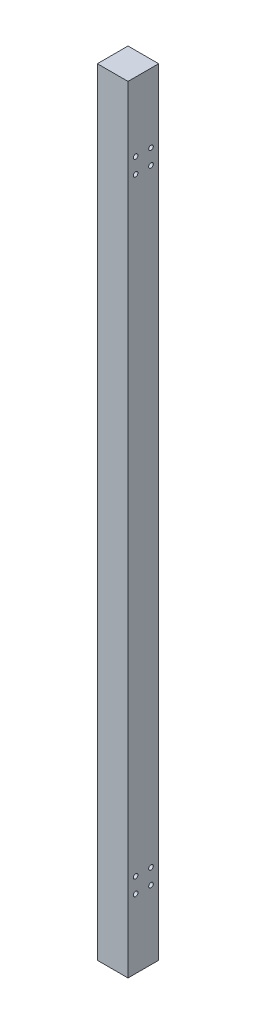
SolidWorks part; units mm, degrees
ref_plane "前视基准面" through (0, 0, 0) normal (0, 0, 1) x (1, 0, 0)
ref_plane "上视基准面" through (0, 0, 0) normal (0, 1, 0) x (1, 0, 0)
ref_plane "右视基准面" through (0, 0, 0) normal (1, 0, 0) x (0, 0, -1)
other "Configuration Table"
sketch "草图1" plane through (0, 0, 0) normal (0, 1, 0) x (1, 0, 0)
  line L1 (-30, 30) -> (30, 30)
  line L2 (-30, 30) -> (-30, -30)
  line L3 (-30, -30) -> (30, -30)
  line L4 (30, 30) -> (30, -30)
  line L5 (-30, 30) -> (30, -30) construction
  line L6 (-30, -30) -> (30, 30) construction
  point P0 (0, 0)
extrude "凸台-拉伸1" add sketch "草图1" along normal blind 1520
sketch "草图2" plane through (0, 0, 30) normal (0, 0, 1) x (1, 0, 0)
  line L0 (-30, 120) -> (30, 120)
  line L1 (-30, 1520) -> (-30, 0) construction
  line L2 (30, 1520) -> (30, 0) construction
  line L3 (-30, 0) -> (30, 0) construction
  line L4 (-30, 1400) -> (30, 1400)
  line L5 (-30, 1520) -> (30, 1520) construction
  dimension "D1" = 120
  dimension "D2" = 120
sketch "草图4" plane through (0, 0, 30) normal (0, 0, 1) x (1, 0, 0)
  line L0 (0, 1400) -> (0, 120)
  line L1 (-30, 1400) -> (30, 1400) construction
  line L2 (-30, 120) -> (30, 120) construction
  line L3 (30, 1520) -> (30, 0) construction
  line L4 (-30, 0) -> (30, 0) construction
  line L5 (-30, 1520) -> (30, 1520) construction
  point P6 (15, 1330)
  point P7 (15, 190)
  point P8 (15, 1110)
  point P9 (15, 410)
  dimension "D1" = 70
  dimension "D2" = 15
  dimension "D3" = 70
  dimension "D4" = 410
  dimension "D5" = 410
sketch "草图5" plane through (-30, 0, 0) normal (-1, 0, 0) x (0, 0, 1)
  line L0 (-30, 1520) -> (30, 1520) construction
  line L5 (30, 1400) -> (30, 120) construction
  line L6 (30, 0) -> (30, 105)
  circle A0 centre (15, 1385) radius 6
  circle A1 centre (-15, 1385) radius 6
  circle A2 centre (-15, 1355) radius 6
  circle A3 centre (15, 1355) radius 6
  circle A4 centre (15, 165) radius 6
  circle A5 centre (-15, 165) radius 6
  circle A6 centre (-15, 135) radius 6
  circle A7 centre (15, 135) radius 6
  point P0 (15, 1385)
  point P16 (15, 165)
  dimension "D3" = 2
  dimension "D1" = 135
  dimension "D2" = 15
  dimension "D4" = 2
hole_wizard "M8 六角头螺栓的柱形沉头孔1" positions "草图8" profile "草图9" counterbore size "M8" standard "GB"
sketch "草图8" plane through (-30, 0, 0) normal (-1, 0, 0) x (0, 0, 1)
  point P0 (-15, 135)
  point P3 (-15, 165)
  point P6 (15, 165)
  point P9 (15, 135)
  point P12 (-15, 1385)
  point P15 (15, 1385)
  point P18 (15, 1355)
  point P21 (-15, 1355)
sketch "草图9" plane through (-30, 135, -15) normal (0, 1, 0) x (0, 0, 1)
  line L0 (0, 0) -> (0, 60)
  line L1 (0, 60) -> (4.5, 60)
  line L3 (4.5, 60) -> (4.5, 0.5)
  line L4 (4.5, 0.5) -> (9, 0.5)
  line L5 (9, 0.5) -> (9, 0)
  line L7 (9, 0) -> (0, 0)
  line L11 (0, -6.35) -> (0, 107.95) construction
  dimension "通孔孔直径" = 9
  dimension "通孔孔深度" = 60
  dimension "柱形沉头孔直径" = 18
  dimension "柱形沉头孔深度" = 0.5
